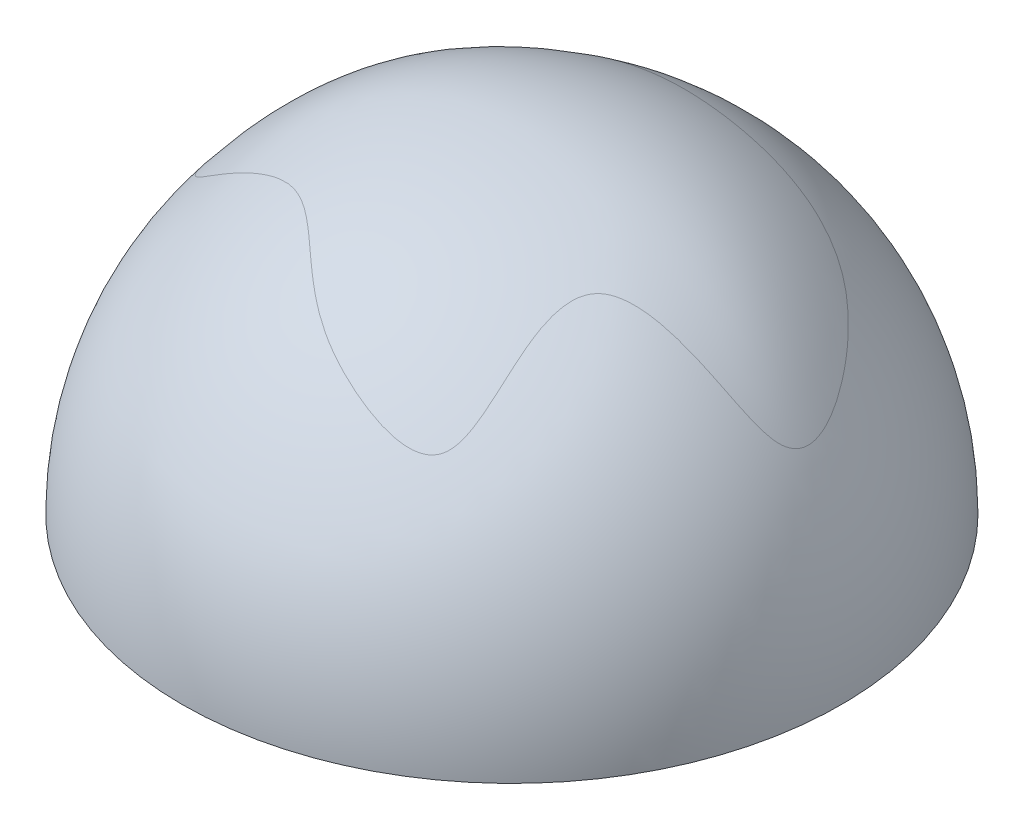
SolidWorks part; units mm, degrees
ref_plane "Front" through (0, 0, 0) normal (0, 0, 1) x (1, 0, 0)
ref_plane "Top" through (0, 0, 0) normal (0, 1, 0) x (1, 0, 0)
ref_plane "Right" through (0, 0, 0) normal (1, 0, 0) x (0, 0, -1)
sketch "Sketch1" plane through (0, 0, 0) normal (0, 0, 1) x (1, 0, 0)
  line L0 (0, 0) -> (0, 59.6577) construction
  arc A0 (0, 59.6577) -> (59.6577, 0) centre (0, 0) cw
surface "Surface-Revolve1" sketch "Sketch1" parameters "D1"=360
sketch "Sketch2" plane through (0, 0, 0) normal (0, 1, 0) x (1, 0, 0)
  spline_without_curve S0
surface "Surface-Trim1"
surface "Surface-Fill1"
surface "Surface-Knit1"
